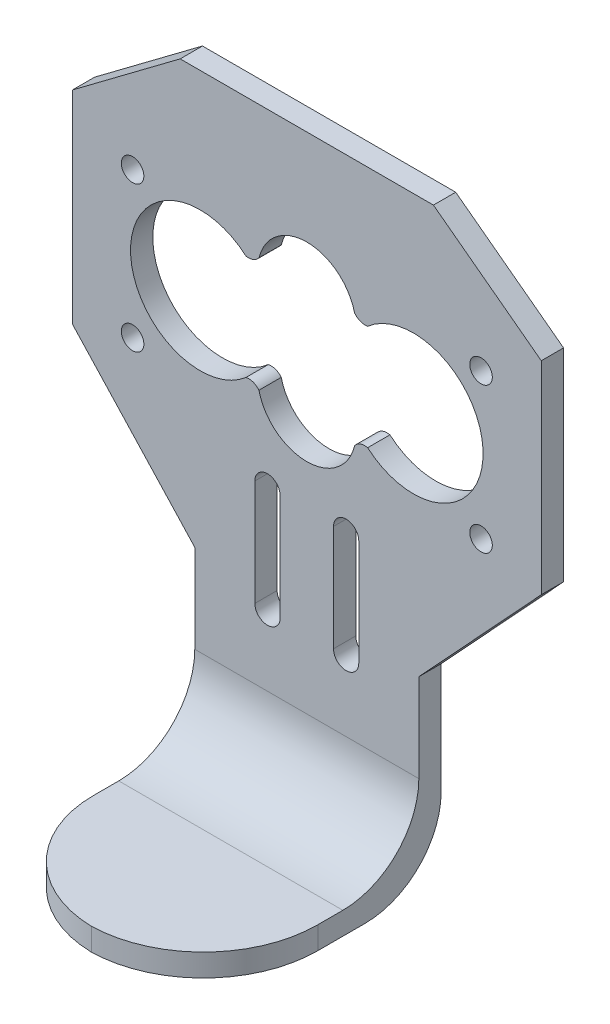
SolidWorks part; units mm, degrees
ref_plane "Front Plane" through (0, 0, 0) normal (0, 0, 1) x (1, 0, 0)
ref_plane "Top Plane" through (0, 0, 0) normal (0, 1, 0) x (1, 0, 0)
ref_plane "Right Plane" through (0, 0, 0) normal (1, 0, 0) x (0, 0, -1)
sketch "Sketch2" plane through (0, 0, 0) normal (0, 0, 1) x (1, 0, 0)
  line L1 (15.4432, 11.5437) -> (28.5955, 1.6795)
  line L2 (28.5955, 1.6795) -> (28.5955, -23.0347)
  line L3 (28.5955, -23.0347) -> (13.6652, -39.1547)
  line L17 (-15.4432, 11.5437) -> (15.4432, 11.5437)
  line L21 (0, 11.5437) -> (0, -75.8383) construction
  line L22 (-28.5955, -11.6754) -> (28.5955, -11.6754) construction
  line L23 (21.25, -3.0566) -> (-21.25, -3.0566) construction
  line L26 (-13.6652, -61.9385) -> (13.6652, -61.9385)
  line L27 (13.6652, -39.1547) -> (13.6652, -61.9385)
  line L28 (4.796, -41.4152) -> (4.796, -28.4894) construction
  line L29 (22.75, -1.6816) -> (22.75, -22.1816) construction
  line L33 (-13.6652, -39.1547) -> (-13.6652, -61.9385)
  line L34 (-4.796, -41.4152) -> (-4.796, -28.4894) construction
  line L36 (-3.2547, -41.4152) -> (-3.2547, -28.4894)
  line L37 (3.2547, -41.4152) -> (3.2547, -28.4894)
  line L38 (-28.5955, -23.0347) -> (-13.6652, -39.1547)
  line L39 (-28.5955, 1.6795) -> (-28.5955, -23.0347)
  line L40 (-15.4432, 11.5437) -> (-28.5955, 1.6795)
  line L41 (-6.3373, -41.4152) -> (-6.3373, -28.4894)
  line L42 (6.3373, -41.4152) -> (6.3373, -28.4894)
  line L43 (0.0001, -6.0795) -> (0.0001, -17.2754) construction
  line L44 (4.796, -34.9523) -> (-4.796, -34.9523) construction
  line L45 (0, -34.9523) -> (0, -61.9385) construction
  line L46 (22.75, -22.1816) -> (-22.75, -22.1816) construction
  line L47 (-22.75, -22.1816) -> (-22.75, -1.6816) construction
  line L48 (-22.75, -1.6816) -> (22.75, -1.6816) construction
  line L49 (13.0001, -20.1816) -> (13.0001, -22.1816) construction
  circle A5 centre (-21.25, -3.0566) radius 1.375
  circle A6 centre (-21.25, -20.8066) radius 1.375
  circle A7 centre (21.25, -3.0566) radius 1.375
  circle A8 centre (21.25, -20.8066) radius 1.375
  arc A11 (-3.2547, -41.4152) -> (-6.3373, -41.4152) centre (-4.796, -41.4152) cw
  arc A12 (-6.3373, -28.4894) -> (-3.2547, -28.4894) centre (-4.796, -28.4894) cw
  arc A13 (3.2547, -41.4152) -> (6.3373, -41.4152) centre (4.796, -41.4152) ccw
  arc A14 (6.3373, -28.4894) -> (3.2547, -28.4894) centre (4.796, -28.4894) ccw
  arc A23 (7.4141, -5.275) -> (5.8296, -4.6596) centre (7.1135, -3.7015) cw
  arc A24 (7.4212, -18.0945) -> (5.8396, -18.6538) centre (7.0742, -19.6293) ccw
  arc A25 (-5.8295, -4.6597) -> (-7.4141, -5.2751) centre (-7.1134, -3.7017) cw
  arc A26 (-5.8395, -18.6537) -> (-7.4205, -18.0946) centre (-7.0739, -19.6295) ccw
  arc A27 (7.4141, -5.275) -> (7.4212, -18.0945) centre (13.0001, -11.6817) cw
  arc A28 (5.8296, -4.6596) -> (-5.8295, -4.6597) centre (0.0001, -6.0795) ccw
  arc A29 (-7.4141, -5.2751) -> (-7.4205, -18.0946) centre (-12.9999, -11.682) ccw
  arc A30 (-5.8395, -18.6537) -> (5.8396, -18.6538) centre (0.0001, -17.2754) ccw
  point P2 (0, -0.0795)
  point P6 (0, -23.2754)
  point P7 (-21.4999, -11.6778)
  point P12 (0, -3.0566)
  point P13 (6.5335, -5.1948)
  point P15 (6.5496, -18.1458)
  point P18 (-6.5493, -18.146)
  point P27 (-6.5335, -5.1949)
  point P36 (4.796, -34.9523)
  point P48 (-4.796, -34.9523)
  point P68 (0, -1.6816)
  dimension "D18" = 20.5
  dimension "D19" = 1.6019
  dimension "D13" = 4.796
  dimension "D17" = 26
  dimension "D8" = 6
  dimension "D10" = 22.7838
  dimension "D11" = 2.75
  dimension "D12" = 1.5413
  dimension "D23" = 8.5
  dimension "D24" = 15.9278
  dimension "D25" = 15.9278
  dimension "D26" = 11.1959
  dimension "D3" = 8.4999
  dimension "D4" = 6
  dimension "D5" = 57.191
  dimension "D6" = 9.8642
  dimension "D7" = 24.7142
  dimension "D9" = 16.12
  dimension "D14" = 42.5
  dimension "D15" = 27.3304
  dimension "D16" = 26.9862
  dimension "D20" = 45.5
  dimension "D21" = 2
  dimension "D27" = 1.5735
  dimension "D28" = 1.5735
  dimension "D29" = 1.6019
  dimension "D30" = 5.6
extrude "Boss-Extrude1" add sketch "Sketch2" along normal blind 2.7178
sketch "Sketch4" plane through (0, 0, 2.7178) normal (0, 0, 1) x (1, 0, 0)
  line L0 (13.6652, -61.9385) -> (13.6652, -39.1547) construction
  line L1 (-13.6652, -61.9385) -> (13.6652, -61.9385)
  line L2 (-13.6652, -61.9385) -> (-13.6652, -59.1953)
  line L3 (-13.6652, -59.1953) -> (13.6652, -59.1953)
  line L4 (13.6652, -61.9385) -> (13.6652, -59.1953)
  dimension "D1" = 2.7432
extrude "Boss-Extrude3" add sketch "Sketch4" along normal blind 26.289
fillet "Fillet3" radius 9.271 2 edges at (0, -59.1953, 2.7178) (0, -61.9385, 0)
fillet "Fillet4" radius 13.97 2 edges at (13.6652, -60.5669, 29.0068) (-13.6652, -60.5669, 29.0068)
